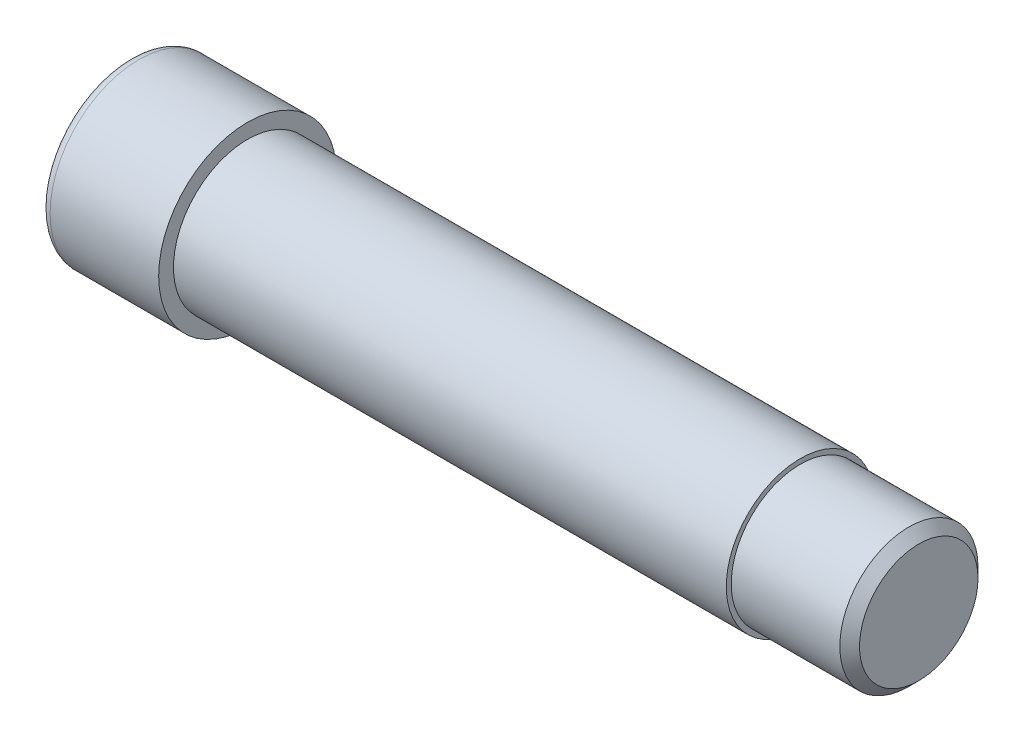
SolidWorks part; units mm, degrees
ref_plane "Plan de face" through (0, 0, 0) normal (0, 0, 1) x (1, 0, 0)
ref_plane "Plan de dessus" through (0, 0, 0) normal (0, 1, 0) x (1, 0, 0)
ref_plane "Plan de droite" through (0, 0, 0) normal (1, 0, 0) x (0, 0, -1)
sketch "Esquisse1" plane through (0, 0, 0) normal (0, 1, 0) x (1, 0, 0)
  line L0 (0, 0) -> (-78.8667, 0) construction
  line L1 (0, 0) -> (0, 7)
  line L2 (0, 7) -> (-12, 7)
  line L3 (-12, 7) -> (-12, 7.5)
  line L4 (-12, 7.5) -> (-68, 7.5)
  line L5 (-68, 7.5) -> (-68, 9)
  line L6 (-68, 9) -> (-80, 9)
  line L7 (-80, 9) -> (-80, 0)
  line L8 (-80, 0) -> (0, 0)
  dimension "D1" = 7
  dimension "D2" = 7.5
  dimension "D3" = 9
  dimension "D4" = 12
  dimension "D5" = 56
  dimension "D6" = 12
revolve "Révolution1" add sketch "Esquisse1" angle 360 about L0
chamfer "Chanfrein1" distance 1 angle 45 1 edges at (0, 0, -7)
fillet "Congé1" radius 1 1 edges at (-80, 0, -9)
sketch "Esquisse2" plane through (-80, 0, 0) normal (-1, 0, 0) x (0, 0, 1)
  line L0 (-2.5, -4.3301) -> (-5, 0)
  line L1 (-5, 0) -> (-2.5, 4.3301)
  line L2 (-2.5, 4.3301) -> (2.5, 4.3301)
  line L3 (2.5, 4.3301) -> (5, 0)
  line L4 (5, 0) -> (2.5, -4.3301)
  line L5 (2.5, -4.3301) -> (-2.5, -4.3301)
extrude "Enlèv. mat.-Extru.1" cut sketch "Esquisse2" against normal blind 10
fillet "Congé2" radius 0.5 18 edges at (-80, -2.1651, 3.75) (-80, -4.3301, 0) (-80, 2.1651, 3.75) (-75, 0, -5) (-70, -2.1651, -3.75) (-75, -4.3301, -2.5) (-80, -2.1651, -3.75) (-70, -4.3301, 0) (-75, -4.3301, 2.5) (-70, 2.1651, 3.75) (-70, -2.1651, 3.75) (-75, 0, 5) (-75, 4.3301, 2.5) (-75, 4.3301, -2.5) (-80, 2.1651, -3.75) (-80, 4.3301, 0) (-70, 2.1651, -3.75) (-70, 4.3301, 0)
